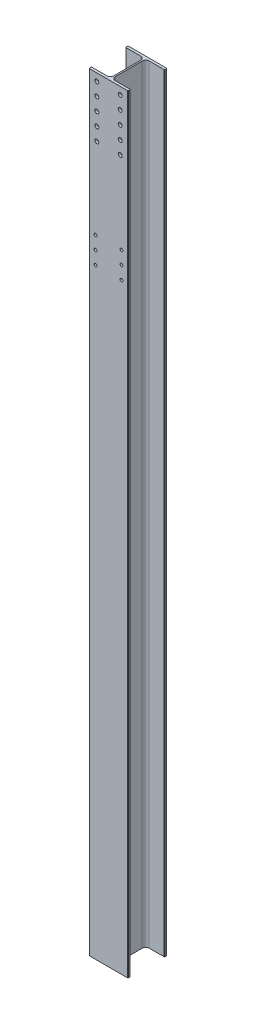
SolidWorks part; units mm, degrees
ref_plane "Płaszczyzna przednia" through (0, 0, 0) normal (0, 0, 1) x (1, 0, 0)
ref_plane "Płaszczyzna górna" through (0, 0, 0) normal (0, 1, 0) x (1, 0, 0)
ref_plane "Płaszczyzna prawa" through (0, 0, 0) normal (1, 0, 0) x (0, 0, -1)
sketch "Szkic1" plane through (0, 0, 0) normal (0, 0, 1) x (1, 0, 0)
  line L0 (0, 0) -> (0, 5914)
  dimension "D1" = 5914
other "Heb 300 - configured HEB 300<OBROBIONA>(1)"
ref_plane "Płaszczyzna1" through (0, 0, 0) normal (0, 1, 0) x (-1, 0, 0)
sketch "Szkic11" plane through (0, 0, 0) normal (0, 1, 0) x (-1, 0, 0)
  line L0 (-147, 150) -> (147, 150)
  line L1 (-150, 150) -> (150, 150) construction
  line L2 (-150, 150) -> (-150, 131) construction
  line L3 (-150, -150) -> (150, -150) construction
  line L4 (150, 150) -> (150, 131) construction
  line L5 (-150, 150) -> (150, -150) construction
  line L6 (-150, -150) -> (150, 150) construction
  line L7 (-147, 131) -> (-32.5, 131)
  line L8 (-147, -150) -> (147, -150)
  line L9 (-147, -131) -> (-32.5, -131)
  line L10 (-5.5, 104) -> (-5.5, -104)
  line L11 (0, 131) -> (0, -131) construction
  line L12 (5.5, 104) -> (5.5, -104)
  line L13 (-150, 147) -> (-150, 134)
  line L14 (150, 147) -> (150, 134)
  line L15 (150, -131) -> (150, -150) construction
  line L16 (150, -134) -> (150, -147)
  line L17 (-150, -131) -> (-150, -150) construction
  line L18 (-150, -134) -> (-150, -147)
  line L19 (32.5, 131) -> (147, 131)
  line L20 (32.5, -131) -> (147, -131)
  arc A0 (-5.5, -104) -> (-32.5, -131) centre (-32.5, -104) cw
  arc A1 (5.5, -104) -> (32.5, -131) centre (32.5, -104) ccw
  arc A2 (-5.5, 104) -> (-32.5, 131) centre (-32.5, 104) ccw
  arc A3 (5.5, 104) -> (32.5, 131) centre (32.5, 104) cw
  arc A4 (150, -147) -> (147, -150) centre (147, -147) cw
  arc A5 (147, -131) -> (150, -134) centre (147, -134) cw
  arc A6 (-150, -147) -> (-147, -150) centre (-147, -147) ccw
  arc A7 (-147, -131) -> (-150, -134) centre (-147, -134) ccw
  arc A8 (147, 131) -> (150, 134) centre (147, 134) ccw
  arc A9 (150, 147) -> (147, 150) centre (147, 147) ccw
  arc A10 (-147, 131) -> (-150, 134) centre (-147, 134) cw
  arc A11 (-150, 147) -> (-147, 150) centre (-147, 147) cw
  point P0 (0, 0)
  point P20 (5.5, -131)
  point P25 (5.5, 131)
  point P50 (0, 0)
  dimension "D6" = 27
  dimension "D7" = 3
  dimension "D1" = 300
  dimension "D2" = 300
  dimension "D3" = 19
  dimension "D4" = 19
  dimension "D5" = 11
sketch "Szkic12" plane through (0, 0, 150) normal (0, 0, 1) x (1, 0, 0)
  line L0 (5.5, 5914) -> (0, 0) construction
  line L1 (-147, 5914) -> (147, 5914) construction
  line L2 (-150, 5914) -> (-150, 0) construction
  circle A0 centre (-90, 5857) radius 15.25
  circle A1 centre (-100, 4828.5) radius 11.25
  circle A2 centre (90, 5857) radius 15.25
  circle A3 centre (90, 5757) radius 15.25
  circle A4 centre (90, 5657) radius 15.25
  circle A5 centre (90, 5557) radius 15.25
  circle A6 centre (90, 5457) radius 15.25
  circle A7 centre (-90, 5757) radius 15.25
  circle A8 centre (-90, 5657) radius 15.25
  circle A9 centre (-90, 5557) radius 15.25
  circle A10 centre (-90, 5457) radius 15.25
  circle A11 centre (100, 4828.5) radius 11.25
  circle A12 centre (100, 4728) radius 11.25
  circle A13 centre (100, 4627.5) radius 11.25
  circle A14 centre (-100, 4728) radius 11.25
  circle A15 centre (-100, 4627.5) radius 11.25
  dimension "D5" = 57
  dimension "D6" = 60
  dimension "D7" = 30.5
  dimension "D8" = 1085.5
  dimension "D9" = 22.5
  dimension "D10" = 50
  dimension "D1" = 2
  dimension "D2" = 5
  dimension "D3" = 2
  dimension "D4" = 3
extrude "Wytnij-wyciągnięcie1" cut sketch "Szkic12" against normal blind 20
